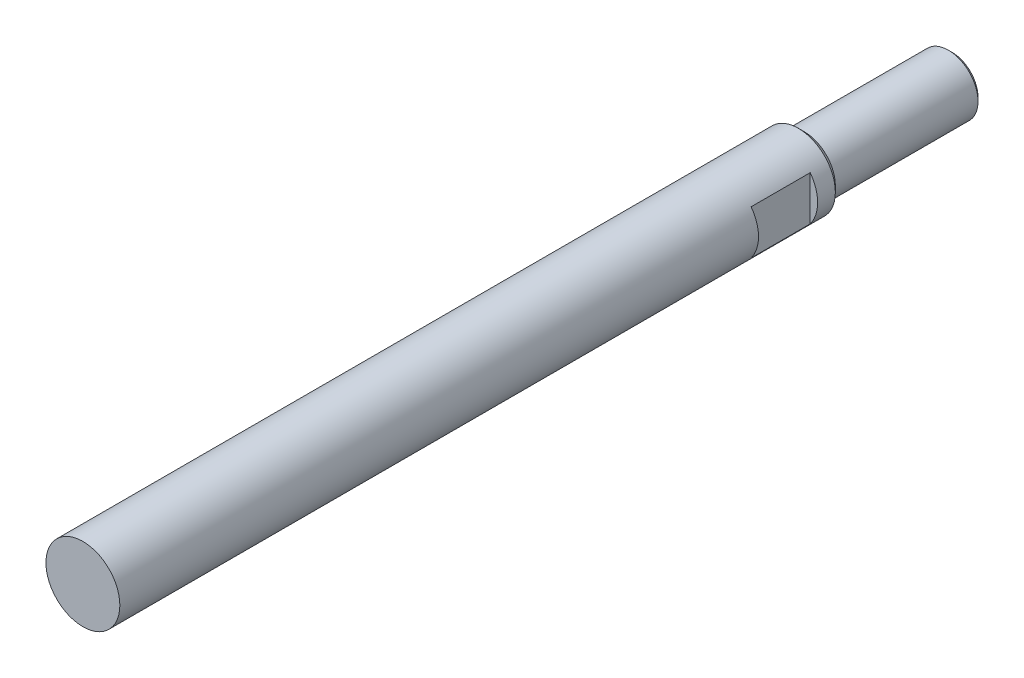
SolidWorks part; units mm, degrees
ref_plane "Face" through (0, 0, 0) normal (0, 0, 1) x (1, 0, 0)
ref_plane "Dessus" through (0, 0, 0) normal (0, 1, 0) x (1, 0, 0)
ref_plane "Droite" through (0, 0, 0) normal (1, 0, 0) x (0, 0, -1)
sketch "Esquisse1" plane through (0, 0, 0) normal (0, 0, 1) x (1, 0, 0)
  circle A0 centre (0, 0) radius 12.5
  dimension "D1" = 25
extrude "Extrusion1" add sketch "Esquisse1" along normal blind 244
sketch "Esquisse2" plane through (0, 0, 0) normal (0, 0, -1) x (-1, 0, 0)
  circle A0 centre (0, 0) radius 10
  dimension "D1" = 20
extrude "Extrusion2" add sketch "Esquisse2" along normal blind 50
chamfer "Chanfrein1" distance 1.25 angle 45 1 edges at (-10, 0, -50)
chamfer "Chanfrein2" distance 2 angle 45 1 edges at (12.5, 0, 0)
sketch "Esquisse3" plane through (0, 0, 0) normal (0, 1, 0) x (1, 0, 0)
  line L1 (18.4526, -7.993) -> (10, -7.993)
  line L2 (18.4526, -7.993) -> (18.4526, -27.993)
  line L3 (18.4526, -27.993) -> (10, -27.993)
  line L4 (10, -7.993) -> (10, -27.993)
  line L5 (-18.57, -7.993) -> (-10, -7.993)
  line L6 (-18.57, -7.993) -> (-18.57, -27.993)
  line L7 (-18.57, -27.993) -> (-10, -27.993)
  line L8 (-10, -7.993) -> (-10, -27.993)
  dimension "D1" = 20
  dimension "D2" = 10
  dimension "D3" = 20
  dimension "D4" = 20
extrude "Enlèv. mat.-Extru.1" cut sketch "Esquisse3" against normal mid plane 30
